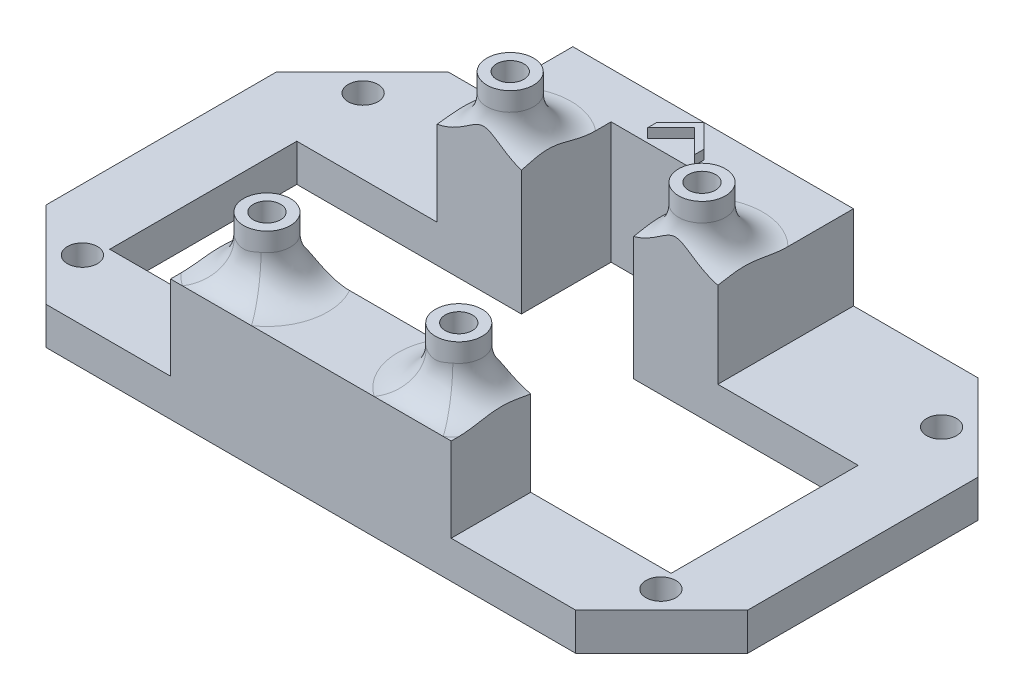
SolidWorks part; units mm, degrees
ref_plane "Спереди" through (0, 0, 0) normal (0, 0, 1) x (1, 0, 0)
ref_plane "Сверху" through (0, 0, 0) normal (0, 1, 0) x (1, 0, 0)
ref_plane "Справа" through (0, 0, 0) normal (1, 0, 0) x (0, 0, -1)
sketch "Sketch1" plane through (0, 0, 0) normal (0, 1, 0) x (1, 0, 0)
  line L0 (0, 21.5) -> (0, -21.5) construction
  line L1 (37.5, -21.5) -> (-37.5, -21.5)
  line L2 (37.5, -21.5) -> (37.5, 21.5)
  line L3 (37.5, 21.5) -> (-37.5, 21.5)
  line L4 (-37.5, -21.5) -> (-37.5, 21.5)
  line L5 (37.5, -21.5) -> (-37.5, 21.5) construction
  line L6 (37.5, 21.5) -> (-37.5, -21.5) construction
  line L8 (30.915, -15) -> (-30.915, -15) construction
  line L9 (30.915, -15) -> (30.915, 15) construction
  line L10 (30.915, 15) -> (-30.915, 15) construction
  line L11 (-30.915, -15) -> (-30.915, 15) construction
  line L12 (30.915, -15) -> (-30.915, 15) construction
  line L13 (30.915, 15) -> (-30.915, -15) construction
  circle A0 centre (-30.915, 15) radius 1.6
  circle A1 centre (30.915, 15) radius 1.6
  circle A2 centre (30.915, -15) radius 1.6
  circle A3 centre (-30.915, -15) radius 1.6
  point P0 (0, 0)
  point P8 (0, 0)
  dimension "D5" = 3.2
  dimension "D1" = 75
  dimension "D2" = 43
  dimension "D3" = 61.83
  dimension "D4" = 30
extrude "Boss-Extrude1" add sketch "Sketch1" along normal blind 4
sketch "Sketch2" plane through (0, 4, 0) normal (0, 1, 0) x (1, 0, 0)
  line L0 (0, 21.5) -> (0, -21.5) construction
  line L1 (37.5, 21.5) -> (-37.5, 21.5) construction
  line L2 (-37.5, -21.5) -> (37.5, -21.5) construction
  line L4 (15, -21.5) -> (-15, -21.5)
  line L5 (15, -21.5) -> (15, 21.5)
  line L6 (15, 21.5) -> (-15, 21.5)
  line L7 (-15, -21.5) -> (-15, 21.5)
  line L8 (15, -21.5) -> (-15, 21.5) construction
  line L9 (15, 21.5) -> (-15, -21.5) construction
  point P6 (0, 0)
  dimension "D1" = 30
extrude "Boss-Extrude2" add sketch "Sketch2" along normal blind 9
sketch "Sketch3" plane through (0, 13, 0) normal (0, 1, 0) x (1, 0, 0)
  line L0 (15, 21.5) -> (-15, 21.5) construction
  line L1 (-10.04, -16.15) -> (10.46, -16.15) construction
  line L2 (-10.04, -16.15) -> (-10.04, 9.85) construction
  line L3 (-10.04, 9.85) -> (10.46, 9.85) construction
  line L4 (10.46, -16.15) -> (10.46, 9.85) construction
  line L5 (-10.04, -16.15) -> (10.46, 9.85) construction
  line L6 (-10.04, 9.85) -> (10.46, -16.15) construction
  line L7 (15, -21.5) -> (15, 21.5) construction
  circle A0 centre (-10.04, 9.85) radius 1.45
  circle A1 centre (10.46, 9.85) radius 1.45
  circle A2 centre (-10.04, -16.15) radius 1.45
  circle A3 centre (10.46, -16.15) radius 1.45
  point P0 (0.21, -3.15)
  dimension "D5" = 2.9
  dimension "D1" = 20.5
  dimension "D2" = 26
  dimension "D3" = 11.65
  dimension "D4" = 4.54
extrude "Cut-Extrude1" cut sketch "Sketch3" against normal through all
sketch "Sketch4" plane through (0, 13, 0) normal (0, 1, 0) x (1, 0, 0)
  circle A0 centre (-10.04, 9.85) radius 2.5
  circle A1 centre (10.46, 9.85) radius 2.5
  circle A2 centre (10.46, -16.15) radius 2.5
  circle A3 centre (-10.04, -16.15) radius 2.5
  circle A4 centre (-10.04, 9.85) radius 1.45
  circle A5 centre (10.46, 9.85) radius 1.45
  circle A6 centre (10.46, -16.15) radius 1.45
  circle A7 centre (-10.04, -16.15) radius 1.45
  dimension "D1" = 5
extrude "Boss-Extrude3" add sketch "Sketch4" along normal blind 6
sketch "Sketch5" plane through (0, 13, 0) normal (0, 1, 0) x (1, 0, 0)
  line L0 (0, -21.2859) -> (0, 21.5) construction
  line L1 (15, 21.5) -> (-15, 21.5) construction
  line L2 (-30, 7) -> (-6, 7)
  line L3 (30, -13) -> (-30, -13)
  line L4 (30, -13) -> (30, 7)
  line L5 (-6, 7) -> (-6, 16.5896)
  line L6 (-30, -13) -> (-30, 7)
  line L7 (30, -13) -> (-30, 7) construction
  line L8 (30, 7) -> (-30, -13) construction
  line L9 (-15, -21.5) -> (15, -21.5) construction
  line L10 (-6, 16.5896) -> (6, 16.5896)
  line L11 (6, 16.5896) -> (6, 7)
  line L12 (6, 7) -> (30, 7)
  point P4 (0, -3)
  dimension "D1" = 18.5
  dimension "D2" = 20
  dimension "D3" = 60
  dimension "D4" = 12
extrude "Cut-Extrude2" cut sketch "Sketch5" against normal through all
sketch "Sketch6" plane through (0, 4, 0) normal (0, 1, 0) x (1, 0, 0)
  line L0 (-37.5, -12.3076) -> (-28.3076, -21.5)
  line L1 (-37.5, 21.5) -> (-37.5, -21.5) construction
  line L2 (-37.5, -21.5) -> (-15, -21.5) construction
  line L3 (-28.3076, -21.5) -> (-37.5, -21.5)
  line L4 (-37.5, -21.5) -> (-37.5, -12.3076)
  line L5 (-37.5, 21.5) -> (-37.5, 12.3076)
  line L6 (-37.5, 12.3076) -> (-28.3076, 21.5)
  line L7 (-15, 21.5) -> (-37.5, 21.5) construction
  line L8 (-28.3076, 21.5) -> (-37.5, 21.5)
  line L9 (28.3076, 21.5) -> (37.5, 21.5)
  line L10 (37.5, 21.5) -> (15, 21.5) construction
  line L11 (37.5, 21.5) -> (37.5, 12.3076)
  line L12 (37.5, -21.5) -> (37.5, 21.5) construction
  line L13 (37.5, 12.3076) -> (28.3076, 21.5)
  line L14 (28.3076, -21.5) -> (37.5, -21.5)
  line L15 (15, -21.5) -> (37.5, -21.5) construction
  line L16 (37.5, -21.5) -> (37.5, -12.3076)
  line L17 (37.5, -12.3076) -> (28.3076, -21.5)
  dimension "D1" = 13
extrude "Cut-Extrude3" cut sketch "Sketch6" against normal through all
sketch "Sketch7" plane through (0, 13, 0) normal (0, 1, 0) x (1, 0, 0)
  line L0 (0, 16.5896) -> (0, 21.5) construction
  line L1 (6, 16.5896) -> (-6, 16.5896) construction
  line L2 (15, 21.5) -> (-15, 21.5) construction
  line L3 (0, 20.5) -> (-2.5, 18)
  line L4 (-2.5, 18) -> (-2.5, 17)
  line L5 (-2.5, 17) -> (0, 19.5)
  line L6 (0, 19.5) -> (2.5, 17)
  line L7 (2.5, 17) -> (2.5, 18)
  line L8 (2.5, 18) -> (0, 20.5)
  dimension "D1" = 1
  dimension "D2" = 5
  dimension "D3" = 2.5
  dimension "D4" = 1
extrude "Boss-Extrude4" add sketch "Sketch7" along normal blind 1
fillet "Fillet1" radius 4 4 edges at (-10.04, 13, 18.65) (10.46, 13, 18.65) (10.46, 13, -7.35) (-10.04, 13, -7.35)
